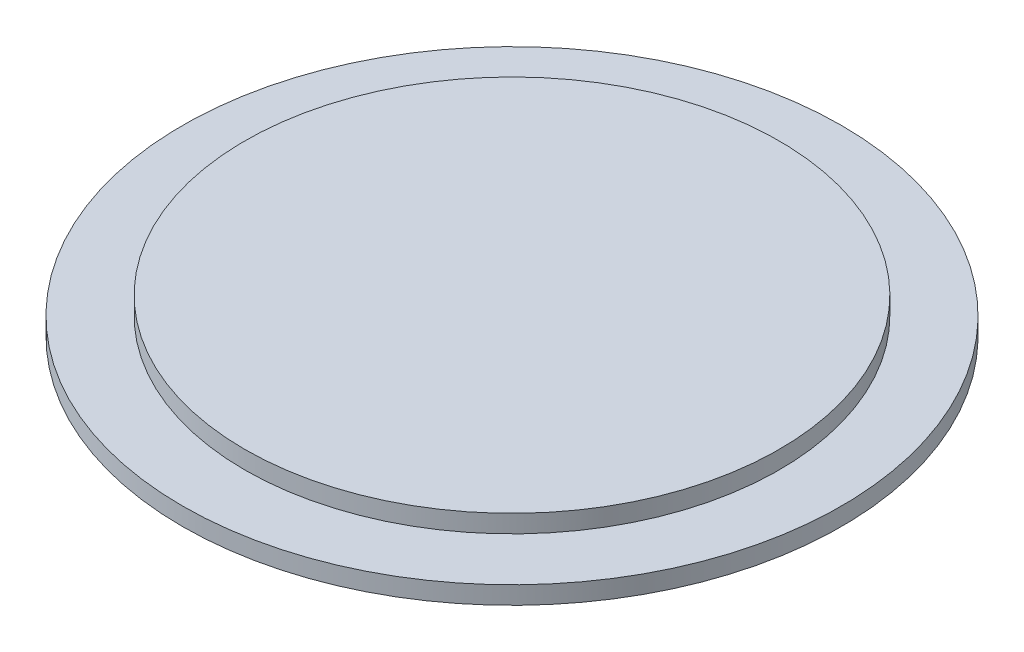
SolidWorks part; units mm, degrees
ref_plane "face" through (0, 0, 0) normal (0, 0, 1) x (1, 0, 0)
ref_plane "dessus" through (0, 0, 0) normal (0, 1, 0) x (1, 0, 0)
ref_plane "profil" through (0, 0, 0) normal (1, 0, 0) x (0, 0, -1)
sketch "Esquisse1" plane through (0, 0, 0) normal (0, 0, 1) x (1, 0, 0)
  line L0 (0, 18.7921) -> (0, -8.8642) construction
  line L1 (0, 0) -> (18.5, 0)
  line L2 (18.5, 0) -> (18.5, 1)
  line L3 (18.5, 1) -> (15, 1)
  line L4 (15, 1) -> (15, 2)
  line L5 (15, 2) -> (0, 2)
  line L6 (0, 2) -> (0, 0)
  dimension "D1" = 1
  dimension "D2" = 2
  dimension "D3" = 18.5
  dimension "D4" = 15
revolve "Base-Révolution" add sketch "Esquisse1" angle 360 about L0
